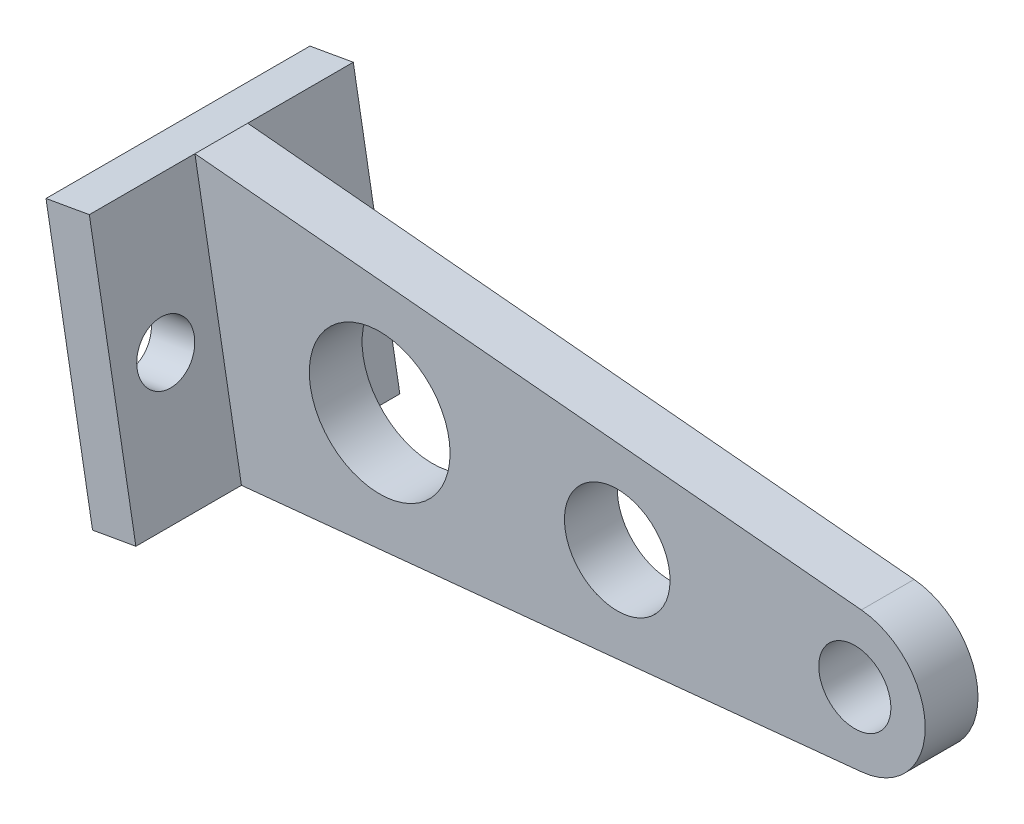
SolidWorks part; units mm, degrees
ref_plane "Face" through (0, 0, 0) normal (0, 0, 1) x (1, 0, 0)
ref_plane "Dessus" through (0, 0, 0) normal (0, 1, 0) x (1, 0, 0)
ref_plane "Droite" through (0, 0, 0) normal (1, 0, 0) x (0, 0, -1)
sketch "Esquisse1" plane through (0, 0, 0) normal (0, 0, 1) x (1, 0, 0)
  line L0 (0, 0) -> (111.9562, 0) construction
  line L1 (54.7398, 7.9657) -> (-21, 15)
  line L2 (54.7948, -7.9604) -> (-15.7102, -15)
  line L3 (-15.7102, -15) -> (-21, 15)
  line L4 (0, 49.8828) -> (0, -49.0421) construction
  circle A0 centre (0, 0) radius 8
  circle A1 centre (27, 0) radius 6
  circle A2 centre (54, 0) radius 4.1
  arc A3 (54.7948, -7.9604) -> (54.7398, 7.9657) centre (54, 0) ccw
  dimension "D1" = 16
  dimension "D2" = 12
  dimension "D3" = 8.2
  dimension "D6" = 16
  dimension "D4" = 27
  dimension "D5" = 27
  dimension "D7" = 75
  dimension "D8" = 15
  dimension "D9" = 15
  dimension "D10" = 10
extrude "Base-Extrusion" add sketch "Esquisse1" along normal mid plane 6
sketch "Esquisse2" plane through (-17.8016, -3.1389, 0) normal (-0.9848, -0.1736, 0) x (0, 0, 1)
  line L0 (3, 18.4187) -> (-3, 18.4187) construction
  line L1 (15, 18.4187) -> (-15, 18.4187)
  line L2 (15, 18.4187) -> (15, -12.0441)
  line L3 (15, -12.0441) -> (-15, -12.0441)
  line L4 (-15, 18.4187) -> (-15, -12.0441)
  line L5 (3, -12.0441) -> (-3, -12.0441) construction
  dimension "D1" = 30
  dimension "D2" = 15
extrude "Boss.-Extru.1" add sketch "Esquisse2" along normal blind 5
sketch "Esquisse3" plane through (-22.7257, -4.0071, 0) normal (-0.9848, -0.1736, 0) x (0, 0, 1)
  line L1 (-15, -12.0441) -> (15, -12.0441) construction
  circle A0 centre (9, 2.9559) radius 3.25
  circle A1 centre (-9, 2.9559) radius 3.25
  dimension "D2" = 6.5
  dimension "D3" = 6.5
  dimension "D1" = 18
  dimension "D4" = 15
  dimension "D5" = 9
extrude "Enlèv. mat.-Extru.1" cut sketch "Esquisse3" against normal blind 5
